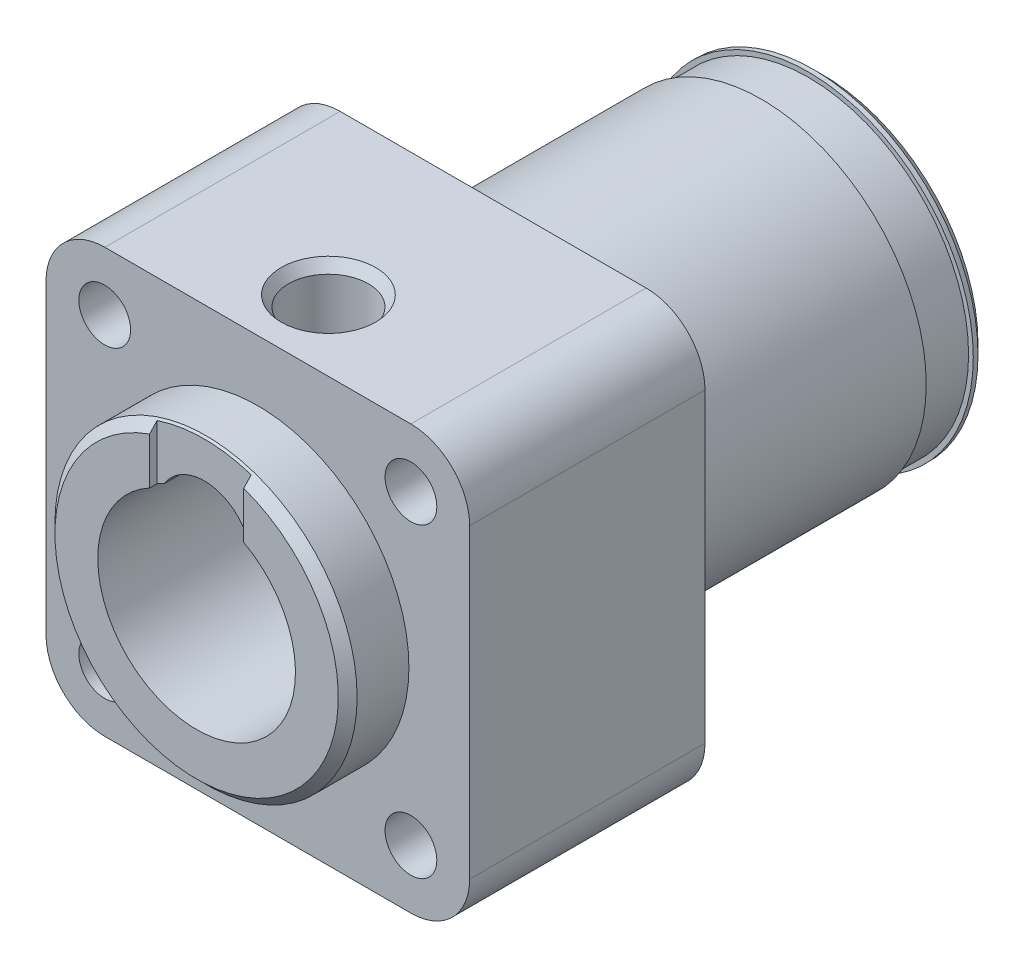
SolidWorks part; units mm, degrees
ref_plane "Face" through (0, 0, 0) normal (0, 0, 1) x (1, 0, 0)
ref_plane "Dessus" through (0, 0, 0) normal (0, 1, 0) x (1, 0, 0)
ref_plane "Droite" through (0, 0, 0) normal (1, 0, 0) x (0, 0, -1)
sketch "Esquisse1" plane through (0, 0, 0) normal (0, 0, 1) x (1, 0, 0)
  circle A0 centre (0, 0) radius 30
  dimension "D1" = 60
extrude "Boss.-Extru.1" add sketch "Esquisse1" along normal blind 66.5
sketch "Esquisse2" plane through (0, 0, 0) normal (1, 0, 0) x (0, 0, -1)
  line L0 (-66.5, 0) -> (12.8502, 0) construction
  line L1 (-66.5, 30) -> (-66.5, -30) construction
  line L2 (0, -30) -> (0, 30) construction
  line L3 (0, 17.5) -> (-35, 17.5)
  line L4 (-35, 17.5) -> (-35, 30)
  line L5 (-35, 30) -> (0, 30)
  line L6 (0, 30) -> (0, 17.5)
  line L7 (-6.5, 17.5) -> (-6.5, 17)
  line L8 (-6.5, 17) -> (-1.5, 17)
  line L9 (-1.5, 17) -> (-1.5, 17.5)
  line L10 (0, 30) -> (-66.5, 30) construction
  dimension "D1" = 35
  dimension "D2" = 35
  dimension "D3" = 1.5
  dimension "D4" = 5
  dimension "D5" = 34
revolve "Enlèvement de matière-Révolution1" cut sketch "Esquisse2" angle 360 about L0
hole_wizard "Diamètre du perçage Ø21.0 (21)1" positions "Esquisse4" profile "Esquisse3" hole size "Ø21.0" standard "ISO"
sketch "Esquisse4" plane through (0, 0, 0) normal (0, 0, -1) x (-1, 0, 0)
  point P0 (0, 0)
sketch "Esquisse3" plane through (0, 0, 0) normal (1, 0, 0) x (0, 1, 0)
  line L0 (0, 0) -> (0, 66.5)
  line L1 (0, 66.5) -> (10.5, 66.5)
  line L2 (10.5, 66.5) -> (10.5, 0)
  line L5 (10.5, 0) -> (0, 0)
  line L11 (0, -6.35) -> (0, 107.95) construction
  dimension "Diamètre du perçage jusqu'au prochain" = 21
  dimension "Profondeur du perçage jusqu'au prochain" = 66.5
sketch "Esquisse5" plane through (0, 0, 0) normal (0, 0, -1) x (-1, 0, 0)
  circle A0 centre (0, 0) radius 14.5
  dimension "D1" = 29
extrude "Enlèv. mat.-Extru.1" cut sketch "Esquisse5" against normal blind 32
chamfer "Chanfrein1" distance 1 angle 45 1 edges at (17.5, 0, 0)
sketch "Esquisse8" plane through (0, 0, 66.5) normal (0, 0, 1) x (1, 0, 0)
  circle A0 centre (0, 0) radius 16.05
  circle A1 centre (0, 0) radius 30
  circle A2 centre (0, 0) radius 30 construction
  dimension "D1" = 32.1
extrude "Enlèv. mat.-Extru.2" cut sketch "Esquisse8" against normal blind 6.5
chamfer "Chanfrein2" distance 1 angle 45 1 edges at (16.05, 0, 66.5)
sketch "Esquisse9" plane through (0, 0, 60) normal (0, 0, 1) x (1, 0, 0)
  line L0 (0, 0) -> (0, 31.8903) construction
  line L1 (-16.25, 22.5) -> (16.25, 22.5)
  line L2 (-22.5, 16.25) -> (-22.5, -16.25)
  line L3 (-16.25, -22.5) -> (16.25, -22.5)
  line L4 (22.5, 16.25) -> (22.5, -16.25)
  line L5 (0, 0) -> (47.0732, 0) construction
  arc A0 (-22.5, -16.25) -> (-16.25, -22.5) centre (-16.25, -16.25) ccw
  arc A1 (16.25, -22.5) -> (22.5, -16.25) centre (16.25, -16.25) ccw
  arc A2 (22.5, 16.25) -> (16.25, 22.5) centre (16.25, 16.25) ccw
  arc A3 (-16.25, 22.5) -> (-22.5, 16.25) centre (-16.25, 16.25) ccw
  circle A4 centre (0, 0) radius 30
  circle A5 centre (0, 0) radius 30 construction
  point P13 (22.5, -22.5)
  point P16 (22.5, 22.5)
  point P19 (-22.5, 22.5)
  dimension "D5" = 6.25
  dimension "D1" = 22.5
  dimension "D2" = 22.5
  dimension "D3" = 45
  dimension "D4" = 45
extrude "Enlèv. mat.-Extru.3" cut sketch "Esquisse9" against normal blind 28.5
hole_wizard "Trou taraudé M101" positions "Esquisse14" profile "Esquisse15" tap size "M10" standard "ISO"
sketch "Esquisse14" plane through (0, 22.5, 0) normal (0, 1, 0) x (-1, 0, 0)
  line L1 (0, 50) -> (0, -50) construction
  line L2 (-16.25, 60) -> (16.25, 60) construction
  point P0 (0, 52.5)
  dimension "D1" = 7.5
sketch "Esquisse15" plane through (0, 22.5, 52.5) normal (1, 0, 0) x (0, 0, 1)
  line L0 (0, 0) -> (0, 20.0537)
  line L1 (0, 20.0537) -> (4.25, 17.5)
  line L2 (4.25, 17.5) -> (4.25, 1.1068)
  line L3 (4.25, 1.1068) -> (5.025, 0)
  line L5 (5.025, 0) -> (0, 0)
  line L6 (-4.25, 1.1068) -> (-5.025, 0) construction
  line L10 (0, 20.0537) -> (-4.25, 17.5) construction
  line L11 (0, -6.35) -> (0, 107.95) construction
  dimension "Diamètre du trou pour taraudage" = 8.5
  dimension "Profondeur du trou pour taraudage" = 17.5
  dimension "Diamètre du fraisage entrant" = 10.05
  dimension "Angle du fraisage entrant" = 70
  dimension "Angle de pointe" = 118
sketch "Esquisse16" plane through (0, 0, 66.5) normal (0, 0, 1) x (1, 0, 0)
  line L0 (0, 0) -> (0, 27.8948) construction
  line L1 (-4.25, 9.6014) -> (4.3046, 9.5771)
  arc A0 (-4.25, 9.6014) -> (4.3046, 9.5771) centre (0.0199, 7) cw
  circle A1 centre (0, 0) radius 10.5 construction
  dimension "D2" = 5
  dimension "D1" = 7
extrude "Enlèv. mat.-Extru.4" cut sketch "Esquisse16" against normal blind 20
sketch "Esquisse17" plane through (0, 0, 66.5) normal (0, 0, 1) x (1, 0, 0)
  line L0 (0, 0) -> (0, 22.5) construction
  line L1 (-5, 0) -> (5, 0)
  line L2 (-5, 0) -> (-5, 22.5)
  line L3 (-5, 22.5) -> (5, 22.5)
  line L4 (5, 0) -> (5, 22.5)
  line L5 (16.25, 22.5) -> (-16.25, 22.5) construction
  dimension "D1" = 10
extrude "Enlèv. mat.-Extru.5" cut sketch "Esquisse17" against normal blind 0.8
hole_wizard "Dégagement M51" positions "Esquisse11" profile "Esquisse12" hole size "M5" standard "ISO"
sketch "Esquisse11" plane through (0, 0, 60) normal (0, 0, 1) x (1, 0, 0)
  line L10 (-16.2635, 16.2635) -> (16.2635, -16.2635) construction
  line L12 (-16.2635, -16.2635) -> (16.2635, 16.2635) construction
  line L13 (16.25, 22.5) -> (-16.25, 22.5) construction
  line L14 (0, 0) -> (0, 22.5) construction
  circle A0 centre (0, 0) radius 23 construction
  point P0 (-16.2635, 16.2635)
  point P1 (16.2635, 16.2635)
  point P4 (16.2635, -16.2635)
  point P7 (-16.2635, -16.2635)
  dimension "D1" = 45
  dimension "D2" = 46
  dimension "D3" = 90
  dimension "D4" = 6.2365
sketch "Esquisse12" plane through (-16.2635, 16.2635, 60) normal (1, 0, 0) x (0, -1, 0)
  line L0 (0, 0) -> (0, 60)
  line L1 (0, 60) -> (2.75, 60)
  line L2 (2.75, 60) -> (2.75, 0)
  line L5 (2.75, 0) -> (0, 0)
  line L11 (0, -6.35) -> (0, 107.95) construction
  dimension "Diamètre du perçage jusqu'au prochain" = 5.5
  dimension "Profondeur du perçage jusqu'au prochain" = 60
